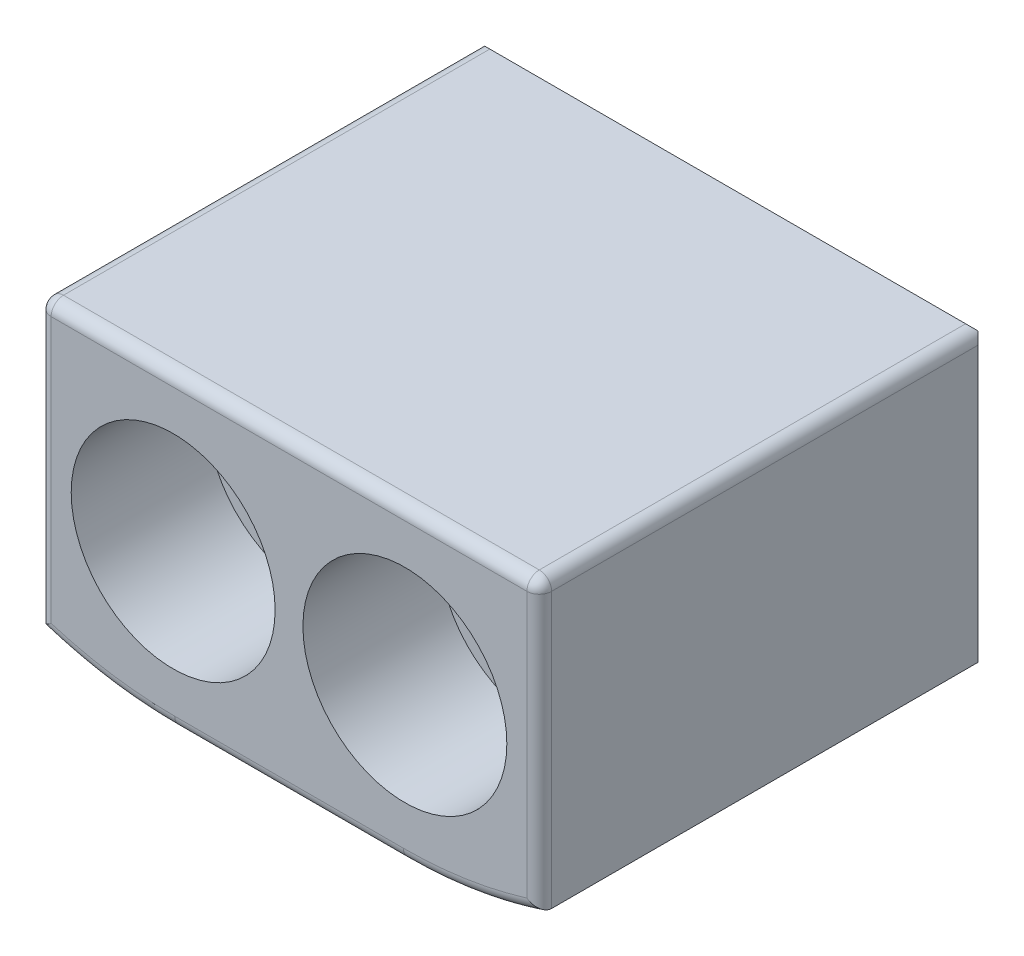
SolidWorks part; units mm, degrees
ref_plane "Front Plane" through (0, 0, 0) normal (0, 0, 1) x (1, 0, 0)
ref_plane "Top Plane" through (0, 0, 0) normal (0, 1, 0) x (1, 0, 0)
ref_plane "Right Plane" through (0, 0, 0) normal (1, 0, 0) x (0, 0, -1)
sketch "Sketch1" plane through (0, 0, 0) normal (0, 0, 1) x (1, 0, 0)
  line L0 (0, -12.7) -> (0, 0) construction
  line L1 (-4.699, -12.7) -> (4.699, -12.7)
  line L2 (-10.287, -11.7991) -> (-10.287, 0)
  line L3 (-10.287, 0) -> (10.287, 0)
  line L4 (10.287, -11.7991) -> (10.287, 0)
  line L5 (0, 0) -> (0, -12.7) construction
  arc A1 (4.699, -12.7) -> (10.287, -11.7991) centre (4.699, 5.08) ccw
  arc A2 (-4.699, -12.7) -> (-10.287, -11.7991) centre (-4.699, 5.08) cw
  dimension "D4" = 5.588
  dimension "D5" = 17.78
  dimension "D1" = 12.7
  dimension "D2" = 10.287
  dimension "D3" = 17.78
  dimension "D7" = 5.588
extrude "Boss-Extrude1" add sketch "Sketch1" against normal blind 19.05
sketch "Sketch3" plane through (0, 0, 0) normal (0, 0, 1) x (1, 0, 0)
  line L0 (-4.699, -12.7) -> (4.699, -12.7) construction
  line L1 (0, 0) -> (0, -18.1399) construction
  line L3 (10.287, 0) -> (-10.287, 0) construction
  line L4 (-10.287, 0) -> (-10.287, -11.7991) construction
  circle A0 centre (4.7625, -6.35) radius 2.794
  circle A1 centre (-4.7625, -6.35) radius 2.794
  dimension "D1" = 5.588
  dimension "D3" = 5.588
  dimension "D2" = 6.35
  dimension "D5" = 9.525
  dimension "D6" = 5.5245
extrude "Cut-Extrude1" cut sketch "Sketch3" against normal through all
sketch "Sketch4" plane through (0, 0, 0) normal (0, 0, 1) x (1, 0, 0)
  circle A0 centre (4.7625, -6.35) radius 4.191
  circle A1 centre (-4.7625, -6.35) radius 4.191
  dimension "D1" = 8.382
  dimension "D2" = 8.382
extrude "Cut-Extrude2" cut sketch "Sketch4" against normal blind 5.588
chamfer "Chamfer3" distance 1.016 angle 45 6 edges at (10.287, -5.8995, -19.05) (0, -12.7, -19.05) (-7.5291, -12.4733, -19.05) (-10.287, -5.8995, -19.05) (0, 0, -19.05) (7.5291, -12.4733, -19.05)
fillet "Fillet3" radius 0.508 8 edges at (-10.287, -5.8995, 0) (-7.5291, -12.4733, 0) (0, -12.7, 0) (10.287, -5.8995, 0) (0, 0, 0) (10.287, 0, -9.017) (-10.287, 0, -9.017) (7.5291, -12.4733, 0)
